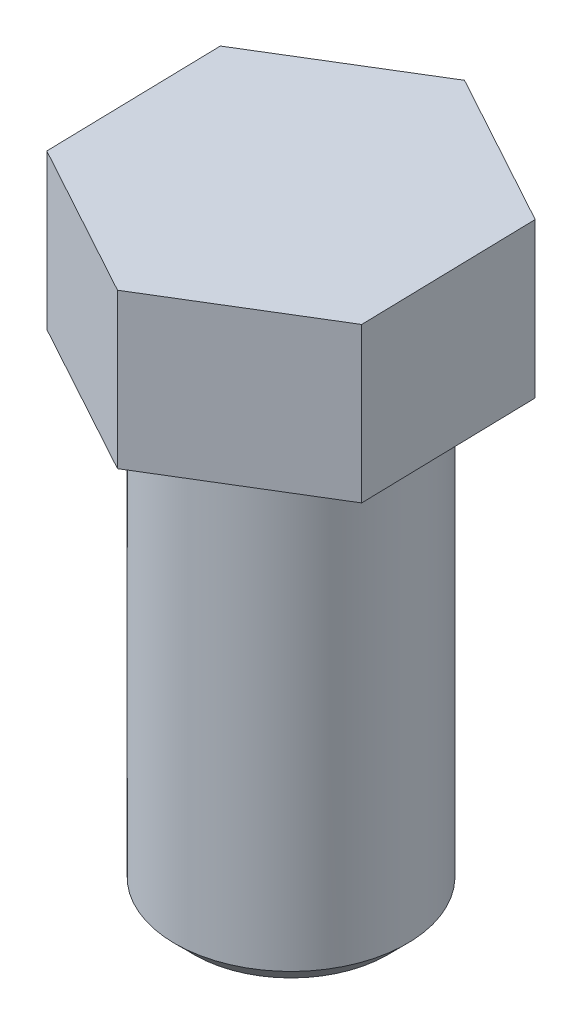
SolidWorks part; units mm, degrees
ref_plane "Plan1" through (0, 0, 0) normal (0, 0, 1) x (1, 0, 0)
ref_plane "Plan2" through (0, 0, 0) normal (0, 1, 0) x (1, 0, 0)
ref_plane "Plan3" through (0, 0, 0) normal (1, 0, 0) x (0, 0, -1)
sketch "Esquisse1" plane through (0, 0, 0) normal (0, 0, 1) x (1, 0, 0)
  line L0 (0, 50) -> (0, -40) construction
  line L2 (-3, 12) -> (0, 12)
  line L7 (-3, 12) -> (-3, 0)
  line L12 (-3, 0) -> (0, 0)
  line L13 (0, 12) -> (0, 0)
  dimension "D3" = 12
  dimension "D7" = 3
revolve "Base-Révolution" add sketch "Esquisse1" angle 360 about L0
chamfer "Chanfrein1" distance 0.5 angle 45 1 edges at (0, 0, 3)
sketch "Esquisse2" plane through (0, 12, 0) normal (0, 1, 0) x (-1, 0, 0)
  line L1 (-3.9278, -2.3918) -> (0.1074, -4.5974)
  line L2 (0.1074, -4.5974) -> (4.0352, -2.2057)
  line L3 (4.0352, -2.2057) -> (3.9278, 2.3918)
  line L4 (3.9278, 2.3918) -> (-0.1074, 4.5974)
  line L5 (-0.1074, 4.5974) -> (-4.0352, 2.2057)
  line L6 (-4.0352, 2.2057) -> (-3.9278, -2.3918)
  circle A0 centre (0, 0) radius 3.9826 construction
extrude "Extrusion1" add sketch "Esquisse2" along normal blind 4
